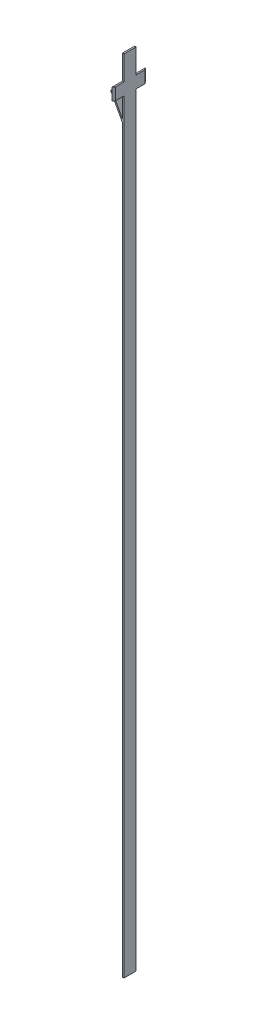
SolidWorks part; units mm, degrees
ref_plane "Front Plane" through (0, 0, 0) normal (0, 0, 1) x (1, 0, 0)
ref_plane "Top Plane" through (0, 0, 0) normal (0, 1, 0) x (1, 0, 0)
ref_plane "Right Plane" through (0, 0, 0) normal (1, 0, 0) x (0, 0, -1)
sketch "Sketch1" plane through (0, 0, 0) normal (0, 1, 0) x (1, 0, 0)
  line L1 (0, 3.3465) -> (0, -3.3465) construction
  line L3 (-8.56, 0) -> (0, 0)
  circle A1 centre (-8.56, 0) radius 11
  point P2 (0, 0)
  point P4 (-12.3017, -0.7158)
  point P7 (-8.9152, -2.8555)
  point P9 (9.0674, 0)
  point P10 (-12.5543, 2.4602)
  point P11 (0.7202, 0)
  point P12 (0, 0)
  point P14 (0, 0)
  point P15 (0, 0)
  point P16 (0, 0)
  point P17 (0, 0)
  dimension "D1" = 22
  dimension "D2" = 6.6931
  dimension "D3" = 8.56
sketch "Sketch2" plane through (0, 0, 0) normal (0, 0, 1) x (1, 0, 0)
  line L0 (0, -15) -> (-4.924, -15.8682)
  line L1 (0, 0) -> (0.61, 0)
  line L2 (0, 0) -> (0, -330)
  line L3 (0, -330) -> (0.61, -330)
  line L4 (0.61, 0) -> (0.61, -330)
  line L5 (-4.924, -15.8682) -> (0, -25)
  line L8 (0, -15.6194) -> (-3.9862, -16.3223)
  line L9 (-3.9862, -16.3223) -> (0, -23.7148)
  point P4 (0, 0)
  dimension "D1" = 330
  dimension "D2" = 0.61
  dimension "D3" = 100
  dimension "D4" = 5
  dimension "D5" = 10
  dimension "D6" = 15
  dimension "D7" = 0.61
  dimension "D8" = 0.61
extrude "Boss-Extrude1" add sketch "Sketch2" along normal mid plane 5 contours L9 L8 L2 L0 L5
sketch "Sketch3" plane through (0, 0, 0) normal (0, 0, 1) x (1, 0, 0)
  line L0 (0.61, 0) -> (0.61, -330) construction
  line L1 (0, -15) -> (0.61, -15)
  line L2 (0, -15) -> (0, -10)
  line L3 (0, -10) -> (0.61, -10)
  line L4 (0.61, -15) -> (0.61, -10)
  line L5 (0, 0) -> (0.61, 0) construction
  dimension "D1" = 5
extrude "Boss-Extrude2" add sketch "Sketch3" along normal mid plane 36
extrude "Cut-Extrude1" cut sketch "Sketch1" against normal through all flip side to cut
